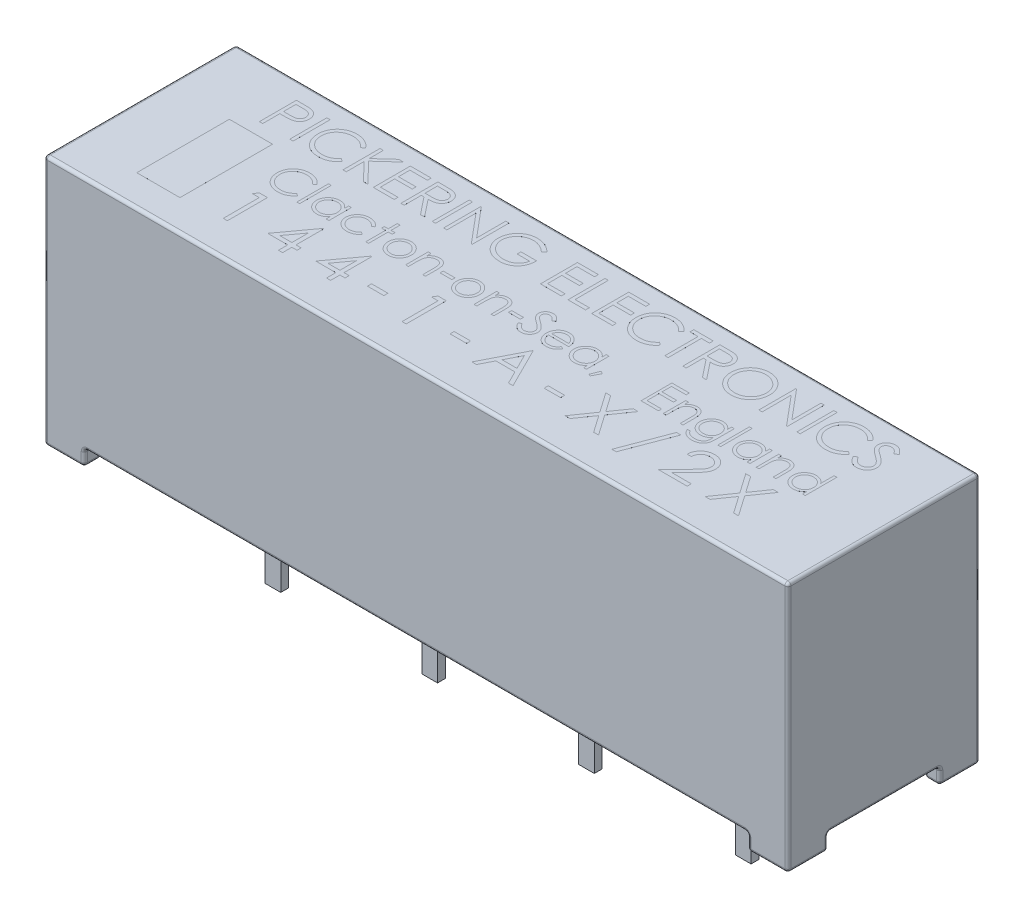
SolidWorks part; units mm, degrees
ref_plane "Front Plane" through (0, 0, 0) normal (0, 0, 1) x (1, 0, 0)
ref_plane "Top Plane" through (0, 0, 0) normal (0, 1, 0) x (1, 0, 0)
ref_plane "Right Plane" through (0, 0, 0) normal (1, 0, 0) x (0, 0, -1)
sketch "Sketch1" plane through (0, 0, 0) normal (0, 1, 0) x (1, 0, 0)
  line L1 (12.05, -3.11) -> (-12.05, -3.11)
  line L2 (12.05, -3.11) -> (12.05, 3.11)
  line L3 (12.05, 3.11) -> (-12.05, 3.11)
  line L4 (-12.05, -3.11) -> (-12.05, 3.11)
  line L5 (12.05, -3.11) -> (-12.05, 3.11) construction
  line L6 (12.05, 3.11) -> (-12.05, -3.11) construction
  point P0 (0, 0)
  dimension "D1" = 6.22
  dimension "D2" = 24.1
extrude "Main Body" add sketch "Sketch1" along normal blind 7.622
sketch "Sketch2" plane through (0, 0, 0) normal (0, -1, 0) x (1, 0, 0)
  line L1 (-12.05, 3.11) -> (-10.75, 3.11)
  line L2 (-12.05, 3.11) -> (-12.05, 1.81)
  line L3 (-12.05, 1.81) -> (-11.5605, 1.81)
  line L4 (-10.75, 3.11) -> (-10.75, 2.5307)
  line L7 (-10.75, 2.5307) -> (-11.5605, 2.5307)
  line L8 (-11.5605, 1.81) -> (-11.5605, 2.5307)
  dimension "D1" = 1.3
  dimension "D2" = 1.3
extrude "Original foot" add sketch "Sketch2" along normal blind 0.508
mirror "Left foot" about plane through (0, 0, 0) normal (0, 0, 1) of "Original foot"
mirror "Right Feet" about plane through (0, 0, 0) normal (1, 0, 0) of "Left foot", "Original foot"
sketch "Sketch3" plane through (0, 0, 0) normal (0, -1, 0) x (1, 0, 0)
  line L0 (12.05, 1.81) -> (12.05, -1.81) construction
  line L1 (-7.366, -0.127) -> (-7.874, -0.127)
  line L2 (-7.366, -0.127) -> (-7.366, 0.127)
  line L3 (-7.366, 0.127) -> (-7.874, 0.127)
  line L4 (-7.874, -0.127) -> (-7.874, 0.127)
  line L5 (-7.366, -0.127) -> (-7.874, 0.127) construction
  line L6 (-7.366, 0.127) -> (-7.874, -0.127) construction
  line L7 (-2.794, -0.127) -> (-2.286, -0.127)
  line L8 (-2.794, -0.127) -> (-2.794, 0.127)
  line L9 (-2.794, 0.127) -> (-2.286, 0.127)
  line L10 (-2.286, -0.127) -> (-2.286, 0.127)
  line L11 (-2.794, -0.127) -> (-2.286, 0.127) construction
  line L12 (-2.794, 0.127) -> (-2.286, -0.127) construction
  line L13 (7.874, -0.127) -> (7.366, -0.127)
  line L14 (7.874, -0.127) -> (7.874, 0.127)
  line L15 (7.874, 0.127) -> (7.366, 0.127)
  line L16 (7.366, -0.127) -> (7.366, 0.127)
  line L17 (7.874, -0.127) -> (7.366, 0.127) construction
  line L18 (7.874, 0.127) -> (7.366, -0.127) construction
  line L19 (2.286, -0.127) -> (2.794, -0.127)
  line L20 (2.286, -0.127) -> (2.286, 0.127)
  line L21 (2.286, 0.127) -> (2.794, 0.127)
  line L22 (2.794, -0.127) -> (2.794, 0.127)
  line L23 (2.286, -0.127) -> (2.794, 0.127) construction
  line L24 (2.286, 0.127) -> (2.794, -0.127) construction
  point P0 (-7.62, 0)
  point P5 (-2.54, 0)
  point P10 (7.62, 0)
  point P15 (2.54, 0)
  dimension "D1" = 0.508
  dimension "D2" = 0.254
  dimension "D3" = 0.508
  dimension "D4" = 0.254
  dimension "D5" = 0.508
  dimension "D6" = 0.254
  dimension "D7" = 0.508
  dimension "D8" = 0.254
  dimension "D9" = 5.08
  dimension "D10" = 5.08
  dimension "D11" = 5.08
  dimension "D12" = 4.43
extrude "Pins" add sketch "Sketch3" along normal blind 3.808
sketch "Sketch4" plane through (0, 7.622, 0) normal (0, 1, 0) x (-1, 0, 0)
  line L0 (9.65, -1.31) -> (-9.65, -1.31) construction
  line L1 (7.85, 0.34) -> (-9.65, 0.34) construction
  line L2 (7.85, 1.99) -> (-9.65, 1.99) construction
  line L3 (-12.05, -3.11) -> (12.05, -3.11) construction
  line L4 (12.05, -3.11) -> (12.05, 3.11) construction
  line L6 (12.05, 3.11) -> (-12.05, 3.11) construction
  line L7 (10.05, -0.89) -> (8.65, -0.89)
  line L8 (10.05, -0.89) -> (10.05, 2.11)
  line L9 (10.05, 2.11) -> (8.65, 2.11)
  line L10 (8.65, -0.89) -> (8.65, 2.11)
  text T0 "PICKERING ELECTRONICS" font "Century Gothic" height 1.2
  text T1 "Clacton-on-Sea,   England" font "Century Gothic" height 1
  text T2 "144-1-A-X/2X" font "Century Gothic" height 1.3
  dimension "D1" = 19.3
  dimension "D2" = 17.5
  dimension "D3" = 17.5
  dimension "D4" = 1.8
  dimension "D5" = 1.65
  dimension "D6" = 1.65
  dimension "D7" = 2.4
  dimension "D8" = 3
  dimension "D9" = 1.4
  dimension "D10" = 2
  dimension "D11" = 1
extrude "Lettering" add sketch "Sketch4" along normal blind 0.0001
fillet "Fillet1" radius 0.1 72 edges at (11.5605, -0.254, -1.81) (12.05, -0.254, -1.81) (12.05, -0.254, 1.81) (11.5605, -0.254, 1.81) (11.1553, 0, -2.5307) (11.8053, 0, -1.81) (11.8053, 0, 1.81) (11.1553, 0, 2.5307) (-11.1553, 0, 2.5307) (-11.1553, 0, -2.5307) (-11.1553, -0.508, -2.5307) (-11.4, -0.508, -3.11) (-12.05, -0.508, -2.46) (10.75, -0.254, -2.5307) (10.75, -0.254, -3.11) (10.75, 0, -2.8203) (11.5605, -0.254, -2.5307) (11.5605, 0, -2.1703) (11.5605, -0.254, 2.5307) (11.5605, 0, 2.1703) (10.75, -0.254, 2.5307) (10.75, -0.254, 3.11) (10.75, 0, 2.8203) (-11.5605, -0.254, 1.81) (-11.5605, -0.254, 2.5307) (-11.5605, 0, 2.1703) (-10.75, -0.254, 2.5307) (-11.8053, -0.508, -1.81) (-12.05, -0.254, -1.81) (-11.5605, -0.254, -1.81) (-11.8053, 0, -1.81) (-11.5605, -0.254, -2.5307) (-11.5605, -0.508, -2.1703) (-11.5605, 0, -2.1703) (-10.75, -0.254, -2.5307) (-10.75, -0.254, -3.11) (-10.75, -0.508, -2.8203) (-10.75, 0, -2.8203) (-11.4, -0.508, 3.11) (-10.75, -0.508, 2.8203) (-11.1553, -0.508, 2.5307) (-11.5605, -0.508, 2.1703) (-11.8053, -0.508, 1.81) (-12.05, -0.508, 2.46) (11.4, -0.508, -3.11) (10.75, -0.508, -2.8203) (11.1553, -0.508, -2.5307) (11.5605, -0.508, -2.1703) (11.8053, -0.508, -1.81) (12.05, -0.508, -2.46) (11.8053, -0.508, 1.81) (11.5605, -0.508, 2.1703) (11.1553, -0.508, 2.5307) (10.75, -0.508, 2.8203) (11.4, -0.508, 3.11) (12.05, -0.508, 2.46) (12.05, 0, 0) (0, 0, -3.11) (0, 7.622, -3.11) (12.05, 3.557, -3.11) (12.05, 7.622, 0) (12.05, 3.557, 3.11) (0, 7.622, 3.11) (-12.05, 7.622, 0) (-12.05, 3.557, -3.11) (-12.05, 3.557, 3.11)
